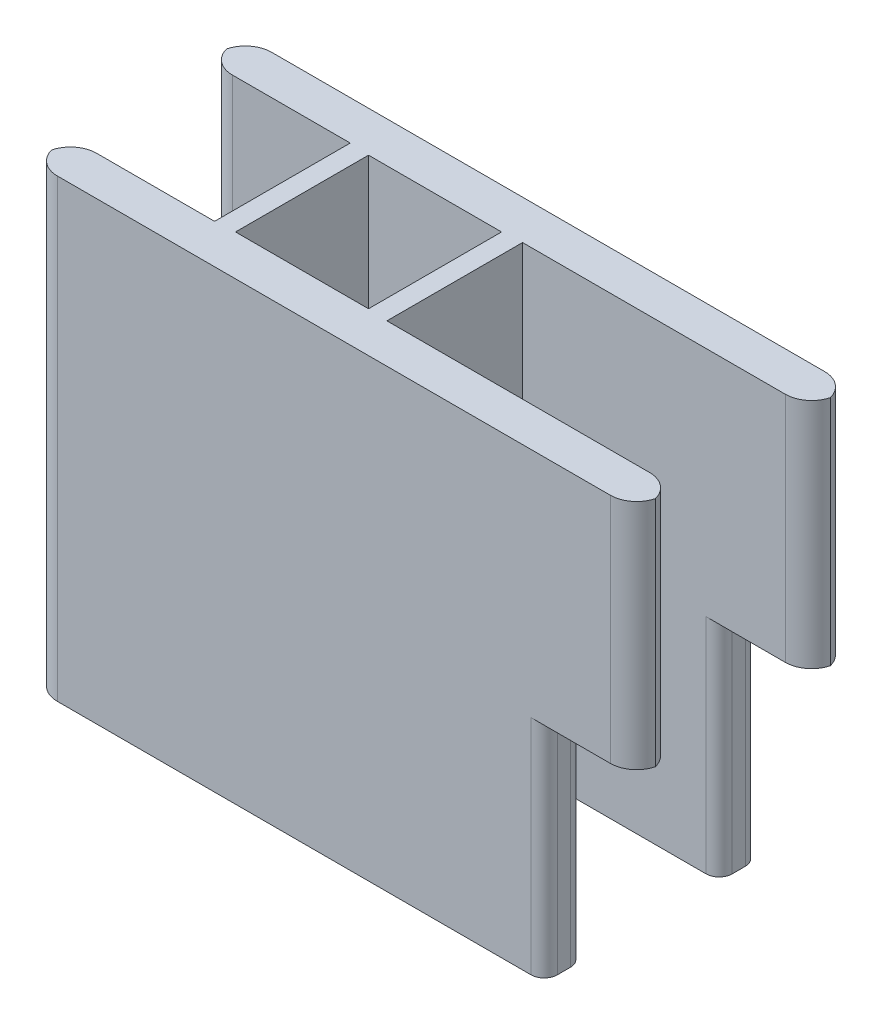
SolidWorks part; units mm, degrees
ref_plane "Plan de face" through (0, 0, 0) normal (0, 0, 1) x (1, 0, 0)
ref_plane "Plan de dessus" through (0, 0, 0) normal (0, 1, 0) x (1, 0, 0)
ref_plane "Plan de droite" through (0, 0, 0) normal (1, 0, 0) x (0, 0, -1)
sketch "Esquisse1" plane through (0, 0, 0) normal (0, 1, 0) x (1, 0, 0)
  line L0 (-7.5167, 17.1833) -> (7.4833, 17.1833)
  line L1 (-31.6667, 20.1833) -> (7.4833, 20.1833)
  line L2 (-31.6667, 20.1833) -> (-31.6667, 17.1833)
  line L3 (-31.6667, 17.1833) -> (-20.6667, 17.1833)
  line L4 (7.4833, 20.1833) -> (7.4833, 17.1833)
  line L6 (-20.6667, 17.1833) -> (-20.6667, 6.8333)
  line L7 (-7.5167, 6.8333) -> (7.4833, 6.8333)
  line L8 (-7.5167, 17.1833) -> (-7.5167, 6.8333)
  line L9 (-31.6667, 6.8333) -> (-20.6667, 6.8333)
  line L10 (-31.6667, 6.8333) -> (-31.6667, 3.8333)
  line L11 (-31.6667, 3.8333) -> (7.4833, 3.8333)
  line L12 (7.4833, 6.8333) -> (7.4833, 3.8333)
  line L13 (-19.1667, 6.9308) -> (-9.0167, 6.9308)
  line L14 (-19.1667, 6.9308) -> (-19.1667, 17.0808)
  line L15 (-19.1667, 17.0808) -> (-9.0167, 17.0808)
  line L16 (-9.0167, 6.9308) -> (-9.0167, 17.0808)
  dimension "D9" = 10.15
  dimension "D1" = 10.35
  dimension "D2" = 15
  dimension "D3" = 15
  dimension "D4" = 11
  dimension "D5" = 11
  dimension "D6" = 3
  dimension "D7" = 3
  dimension "D8" = 39.15
  dimension "D10" = 1.5
  dimension "D11" = 3.1025
  dimension "D12" = 10.15
extrude "Boss.-Extru.1" add sketch "Esquisse1" along normal blind 50
fillet "Congé1" radius 1 8 edges at (-31.6667, 25, -6.8333) (-31.6667, 25, -20.1833) (-31.6667, 25, -17.1833) (-31.6667, 25, -3.8333) (7.4833, 25, -3.8333) (7.4833, 25, -20.1833) (7.4833, 25, -17.1833) (7.4833, 25, -6.8333)
sketch "Esquisse5" plane through (0, 0, 0) normal (0, -1, 0) x (1, 0, 0)
  line L0 (-31.6667, -3.8333) -> (-10.6744, -3.8333)
  line L1 (-30.6667, -3.8333) -> (6.4833, -3.8333) construction
  line L2 (-31.6667, -3.8333) -> (-31.6667, -6.8333)
  line L3 (-31.6667, -6.8333) -> (-20.6667, -6.8333)
  line L4 (-10.6744, -3.8333) -> (-10.6744, -20.1833)
  line L5 (-20.6667, -6.8333) -> (-20.6667, -17.1833)
  line L6 (6.4833, -20.1833) -> (-30.6667, -20.1833) construction
  line L7 (-10.6744, -20.1833) -> (-31.6667, -20.1833)
  line L8 (-31.6667, -17.1833) -> (-20.6667, -17.1833)
  line L9 (-31.6667, -17.1833) -> (-31.6667, -20.1833)
  dimension "D4" = 11
  dimension "D5" = 11
  dimension "D6" = 3
  dimension "D7" = 3
extrude "Boss.-Extru.2" add sketch "Esquisse5" along normal blind 17
fillet "Congé2" radius 1 4 edges at (-31.6667, -8.5, -20.1833) (-31.6667, -8.5, -17.1833) (-31.6667, -8.5, -6.8333) (-31.6667, -8.5, -3.8333)
sketch "Esquisse8" plane through (0, -17, 0) normal (0, -1, 0) x (1, 0, 0)
  line L1 (-40.3375, 3.2249) -> (30.7319, 3.2249)
  line L2 (-40.3375, 3.2249) -> (-40.3375, -30.6584)
  line L3 (-40.3375, -30.6584) -> (30.7319, -30.6584)
  line L4 (30.7319, 3.2249) -> (30.7319, -30.6584)
extrude "Enlèv. mat.-Extru.1" cut sketch "Esquisse8" against normal blind 50
sketch "Esquisse10" plane through (0, 50, 0) normal (0, 1, 0) x (1, 0, 0)
  line L0 (-20.6667, 20.1833) -> (14.5368, 20.1833)
  line L1 (6.4833, 20.1833) -> (-30.6667, 20.1833) construction
  line L2 (14.5368, 20.1833) -> (14.5368, 17.1833)
  line L3 (14.5368, 17.1833) -> (-7.5167, 17.1833)
  line L4 (-7.5167, 17.1833) -> (-7.5167, 6.8333)
  line L5 (-7.5167, 6.8333) -> (14.5368, 6.8333)
  line L6 (14.5368, 6.8333) -> (14.5368, 3.8333)
  line L7 (14.5368, 3.8333) -> (-20.6667, 3.8333)
  line L8 (-30.6667, 3.8333) -> (6.4833, 3.8333) construction
  line L9 (-20.6667, 6.8333) -> (-20.6667, 17.1833)
  line L10 (-19.1667, 6.9308) -> (-9.0167, 6.9308) construction
  line L11 (-19.1667, 17.0808) -> (-9.0167, 17.0808)
  line L12 (-19.1667, 17.0808) -> (-19.1667, 6.9308)
  line L13 (-19.1667, 6.9308) -> (-9.0167, 6.9308)
  line L14 (-9.0167, 17.0808) -> (-9.0167, 6.9308)
  line L16 (-20.6667, 20.1833) -> (-31.6667, 20.1833)
  line L17 (-31.6667, 20.1833) -> (-31.6667, 17.1833)
  line L18 (-31.6667, 17.1833) -> (-20.6667, 17.1833)
  line L19 (-20.6667, 6.8333) -> (-31.6667, 6.8333)
  line L20 (-31.6667, 6.8333) -> (-31.6667, 3.8333)
  line L21 (-31.6667, 3.8333) -> (-20.6667, 3.8333)
  dimension "D1" = 3
  dimension "D2" = 3
  dimension "D3" = 11
  dimension "D4" = 11
extrude "Boss.-Extru.4" add sketch "Esquisse10" along normal blind 17.72
fillet "Congé3" radius 2 8 edges at (14.5368, 58.86, -20.1833) (14.5368, 58.86, -17.1833) (14.5368, 58.86, -6.8333) (14.5368, 58.86, -3.8333) (-31.6667, 58.86, -6.8333) (-31.6667, 58.86, -20.1833) (-31.6667, 58.86, -17.1833) (-31.6667, 58.86, -3.8333)
